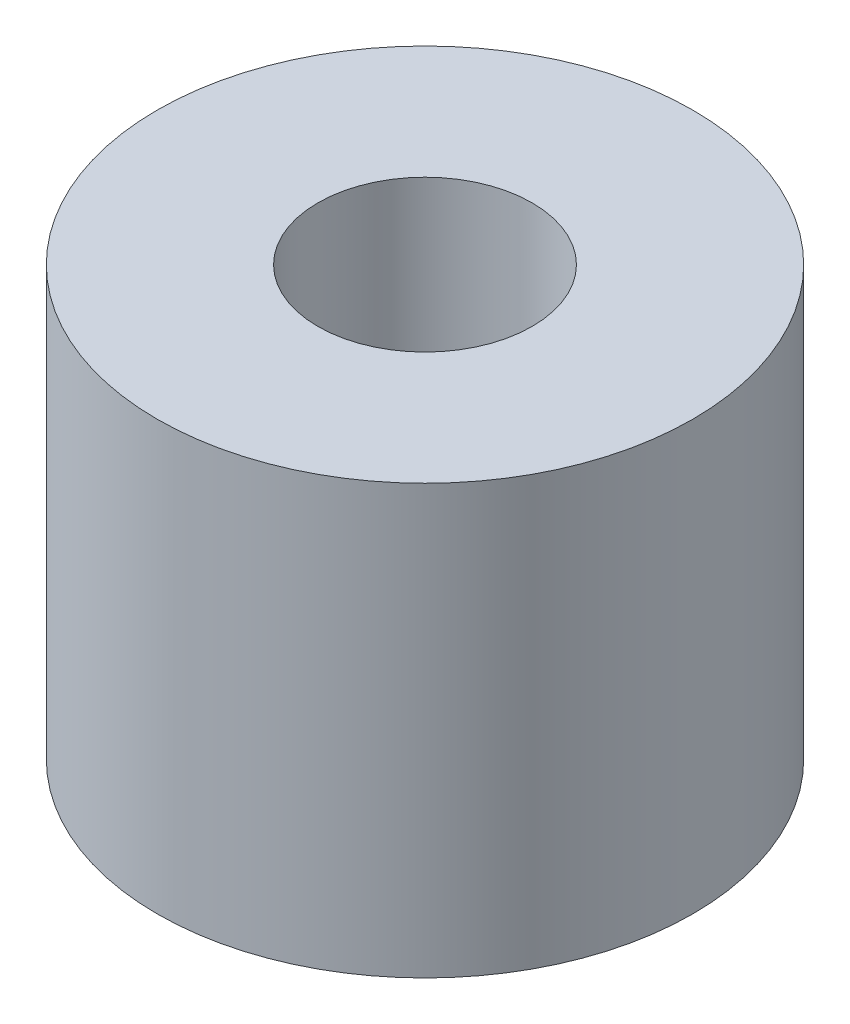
SolidWorks part; units mm, degrees
ref_plane "Front" through (0, 0, 0) normal (0, 0, 1) x (1, 0, 0)
ref_plane "Top" through (0, 0, 0) normal (0, 1, 0) x (1, 0, 0)
ref_plane "Right" through (0, 0, 0) normal (1, 0, 0) x (0, 0, -1)
sketch "Sketch1" plane through (0, 0, 0) normal (0, 1, 0) x (1, 0, 0)
  circle A0 centre (0, 0) radius 5
  circle A1 centre (0, 0) radius 12.5
extrude "Extrude1" add sketch "Sketch1" along normal blind 20
sketch "Sketch2" plane through (0, 0, 0) normal (0, 0, 1) x (1, 0, 0)
  circle A0 centre (0, 10) radius 2
extrude "Cut-Extrude1" cut sketch "Sketch2" against normal blind 20
